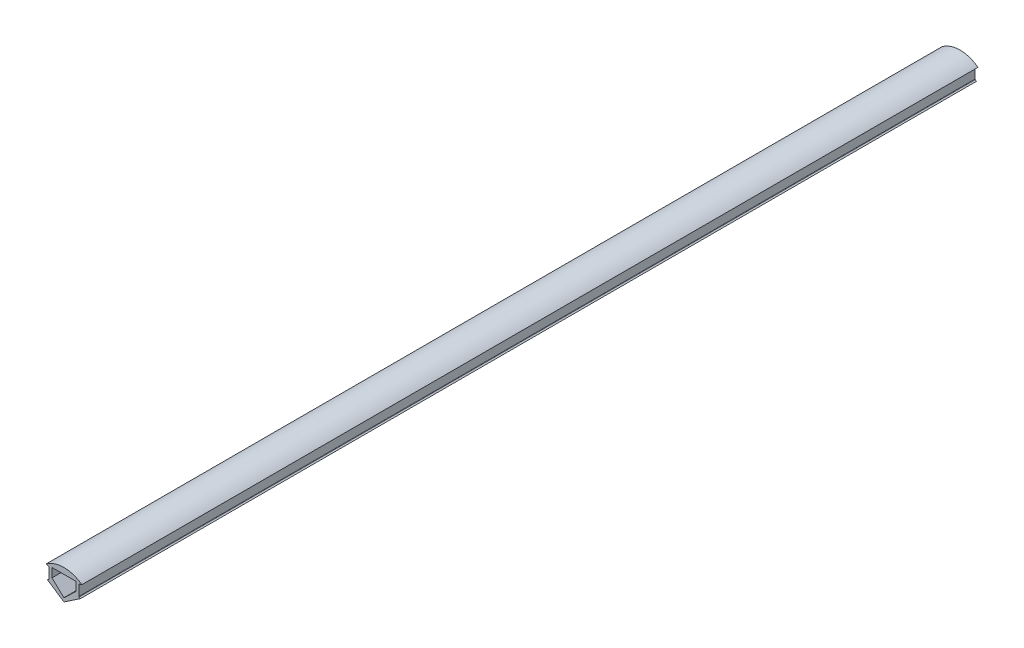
SolidWorks part; units mm, degrees
ref_plane "前视基准面" through (0, 0, 0) normal (0, 0, 1) x (1, 0, 0)
ref_plane "上视基准面" through (0, 0, 0) normal (0, 1, 0) x (1, 0, 0)
ref_plane "右视基准面" through (0, 0, 0) normal (1, 0, 0) x (0, 0, -1)
sketch "草图1" plane through (0, 0, 0) normal (0, 0, 1) x (1, 0, 0)
  line L0 (0, 66.5165) -> (0, -88.0065) construction
  line L1 (6, 3) -> (5.1419, 2.7396)
  line L2 (5, -0.889) -> (5, 2)
  line L3 (5, 2.5483) -> (5, 2)
  line L4 (6, -5) -> (-6, 5) construction
  line L5 (6, 5) -> (-6, -5) construction
  line L6 (-5.5, -1.3117) -> (0, -5)
  line L7 (-5.0942, -1.0587) -> (-5.5, -1.3117)
  line L8 (-6, 5) -> (6, -5) construction
  line L9 (-6, -5) -> (6, 5) construction
  line L10 (-5, 2.5483) -> (-5, 2)
  line L11 (-5, -0.889) -> (-5, 2)
  line L12 (-6, 3) -> (-5.1419, 2.7396)
  line L13 (-4, 3) -> (-4, -0.0161)
  line L14 (5.0942, -1.0587) -> (5.5, -1.3117)
  line L15 (5.5, -1.3117) -> (0, -5)
  line L16 (4, 3) -> (4, -0.0161)
  line L18 (-4, -0.0161) -> (0, -3.7673)
  line L19 (4, -0.0161) -> (0, -3.7673)
  line L21 (-4, 3) -> (4, 3)
  arc A0 (6, 3) -> (-6, 3) centre (0, -5) ccw
  arc A1 (5, -0.889) -> (5.0942, -1.0587) centre (5.2, -0.889) ccw
  arc A2 (5, 2.5483) -> (5.1419, 2.7396) centre (5.2, 2.5483) cw
  arc A3 (-5.0942, -1.0587) -> (-5, -0.889) centre (-5.2, -0.889) ccw
  arc A4 (-5, 2.5483) -> (-5.1419, 2.7396) centre (-5.2, 2.5483) ccw
  point P20 (5, -1)
  point P23 (5, 2.6966)
  point P26 (-5, -1)
  point P29 (-5, 2.6966)
  dimension "D1" = 12
  dimension "D3" = 0.2
  dimension "D2" = 10
extrude "凸台-拉伸1" add sketch "草图1" along normal mid plane 300
